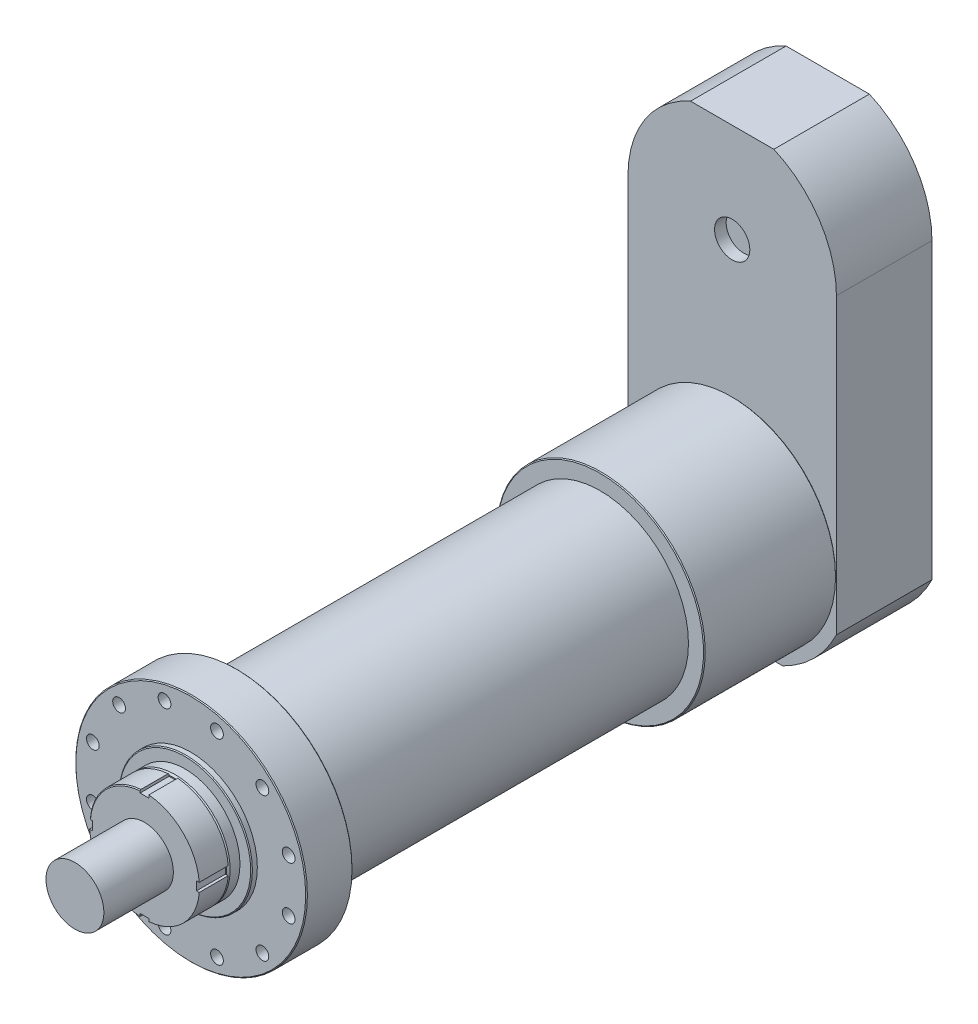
SolidWorks part; units mm, degrees
ref_plane "前视基准面" through (0, 0, 0) normal (0, 0, 1) x (1, 0, 0)
ref_plane "上视基准面" through (0, 0, 0) normal (0, 1, 0) x (1, 0, 0)
ref_plane "右视基准面" through (0, 0, 0) normal (1, 0, 0) x (0, 0, -1)
sketch "草图1" plane through (0, 0, 0) normal (0, 0, 1) x (1, 0, 0)
  circle A0 centre (0, 0) radius 152.5
  dimension "D1" = 305
extrude "凸台-拉伸1" add sketch "草图1" along normal blind 627
sketch "草图2" plane through (0, 0, 627) normal (0, 0, 1) x (1, 0, 0)
  line L0 (0, 0) -> (224.9367, 0) construction
  line L1 (0, 0) -> (223.5406, 59.8975) construction
  circle A0 centre (0, 0) radius 200
  circle A1 centre (0, 0) radius 175 construction
  circle A2 centre (169.037, 45.2933) radius 11
  circle A3 centre (169.037, -45.2933) radius 11
  circle A4 centre (123.7437, -123.7437) radius 11
  circle A5 centre (45.2933, -169.037) radius 11
  circle A6 centre (-45.2933, -169.037) radius 11
  circle A7 centre (-123.7437, -123.7437) radius 11
  circle A8 centre (-169.037, -45.2933) radius 11
  circle A9 centre (-169.037, 45.2933) radius 11
  circle A10 centre (-123.7437, 123.7437) radius 11
  circle A11 centre (-45.2933, 169.037) radius 11
  circle A12 centre (45.2933, 169.037) radius 11
  circle A13 centre (123.7437, 123.7437) radius 11
  point P32 (0, 0)
  dimension "D1" = 400
  dimension "D2" = 350
  dimension "D3" = 22
  dimension "D4" = 15
  dimension "D5" = 12
extrude "凸台-拉伸2" add sketch "草图2" along normal blind 80
sketch "草图3" plane through (0, 0, 707) normal (0, 0, 1) x (1, 0, 0)
  circle A0 centre (0, 0) radius 115
  dimension "D1" = 230
extrude "凸台-拉伸3" add sketch "草图3" along normal blind 10
sketch "草图4" plane through (0, 0, 717) normal (0, 0, 1) x (1, 0, 0)
  circle A0 centre (0, 0) radius 95
  dimension "D1" = 190
extrude "凸台-拉伸4" add sketch "草图4" along normal blind 20
chamfer "倒角1" distance 3 angle 45 1 edges at (95, 0, 737)
sketch "草图5" plane through (0, 0, 737) normal (0, 0, 1) x (1, 0, 0)
  line L0 (-7.5, 94.7035) -> (-7.5, 90)
  line L1 (-7.5, 90) -> (7.5, 90)
  line L2 (7.5, 90) -> (7.5, 94.7035)
  line L3 (94.7035, 7.5) -> (90, 7.5)
  line L4 (90, 7.5) -> (90, -7.5)
  line L5 (90, -7.5) -> (94.7035, -7.5)
  line L6 (7.5, -94.7035) -> (7.5, -90)
  line L7 (7.5, -90) -> (-7.5, -90)
  line L8 (-7.5, -90) -> (-7.5, -94.7035)
  line L9 (-94.7035, -7.5) -> (-90, -7.5)
  line L10 (-90, -7.5) -> (-90, 7.5)
  line L11 (-90, 7.5) -> (-94.7035, 7.5)
  arc A0 (-7.5, 94.7035) -> (-94.7035, 7.5) centre (0, 0) ccw
  arc A1 (-94.7035, -7.5) -> (-7.5, -94.7035) centre (0, 0) ccw
  arc A2 (7.5, -94.7035) -> (94.7035, -7.5) centre (0, 0) ccw
  arc A3 (94.7035, 7.5) -> (7.5, 94.7035) centre (0, 0) ccw
  point P21 (0, 0)
  dimension "D1" = 190
  dimension "D2" = 15
  dimension "D3" = 7.5
  dimension "D4" = 90
  dimension "D5" = 4
extrude "凸台-拉伸5" add sketch "草图5" along normal blind 50
chamfer "倒角2" distance 1.5 angle 45 5 edges at (200, 0, 627) (200, 0, 707) (115, 0, 717) (-67.1751, 67.1751, 737) (-67.1751, 67.1751, 787)
sketch "草图11" plane through (0, 0, 0) normal (0, 0, -1) x (-1, 0, 0)
  circle A0 centre (0, 0) radius 180
  dimension "D1" = 360
extrude "凸台-拉伸10" add sketch "草图11" along normal blind 228
chamfer "倒角5" distance 1.5 angle 45 2 edges at (-180, 0, 0) (-180, 0, -228)
sketch "草图12" plane through (0, 0, -228) normal (0, 0, -1) x (-1, 0, 0)
  line L1 (-87.178, -180) -> (87.178, -180)
  line L2 (-180, -87.178) -> (-180, 420)
  line L3 (-71.9375, 585) -> (71.9375, 585)
  line L4 (180, -87.178) -> (180, 420)
  arc A0 (-180, -87.178) -> (-87.178, -180) centre (0, 0) ccw
  arc A1 (-71.9375, 585) -> (-180, 420) centre (0, 420) ccw
  arc A2 (180, 420) -> (71.9375, 585) centre (0, 420) ccw
  arc A3 (87.178, -180) -> (180, -87.178) centre (0, 0) ccw
  dimension "D5" = 400
  dimension "D6" = 420
  dimension "D7" = 360
  dimension "D2" = 180
  dimension "D3" = 180
  dimension "D4" = 585
extrude "凸台-拉伸11" add sketch "草图12" along normal blind 165 separate body contours L4 A2 L3 A1 L2 A0 L1 M5 | M5
ref_plane "基准面1" through (152.5, 0, 0) normal (1, 0, 0) x (0, 0, -1)
ref_plane "基准面2" through (-152.5, 0, 0) normal (1, 0, 0) x (0, 0, -1)
sketch "草图14" plane through (152.5, 0, 0) normal (1, 0, 0) x (0, 0, -1)
  circle A0 centre (-47, 0) radius 16
  dimension "D1" = 32
  dimension "D2" = 47
sketch "草图16" plane through (-152.5, 0, 0) normal (1, 0, 0) x (0, 0, -1)
  line L0 (0, 152.5) -> (0, -152.5) construction
  line L1 (-628.5, 200) -> (-628.5, -200) construction
  circle A0 centre (-27, 0) radius 16
  circle A1 centre (-551.5, 0) radius 16
  dimension "D1" = 32
  dimension "D2" = 27
  dimension "D3" = 32
  dimension "D4" = 77
extrude "切除-拉伸4" cut sketch "草图16" along normal blind 2
sketch "草图18" plane through (0, 0, -228) normal (0, 0, 1) x (1, 0, 0)
  circle A0 centre (0, 414) radius 30.4407
  dimension "D1" = 414
extrude "切除-拉伸6" cut sketch "草图18" against normal blind 20
sketch "草图19" plane through (0, 0, 787) normal (0, 0, 1) x (1, 0, 0)
  circle A0 centre (0, 0) radius 50
  dimension "D1" = 100
extrude "凸台-拉伸12" add sketch "草图19" along normal blind 120
